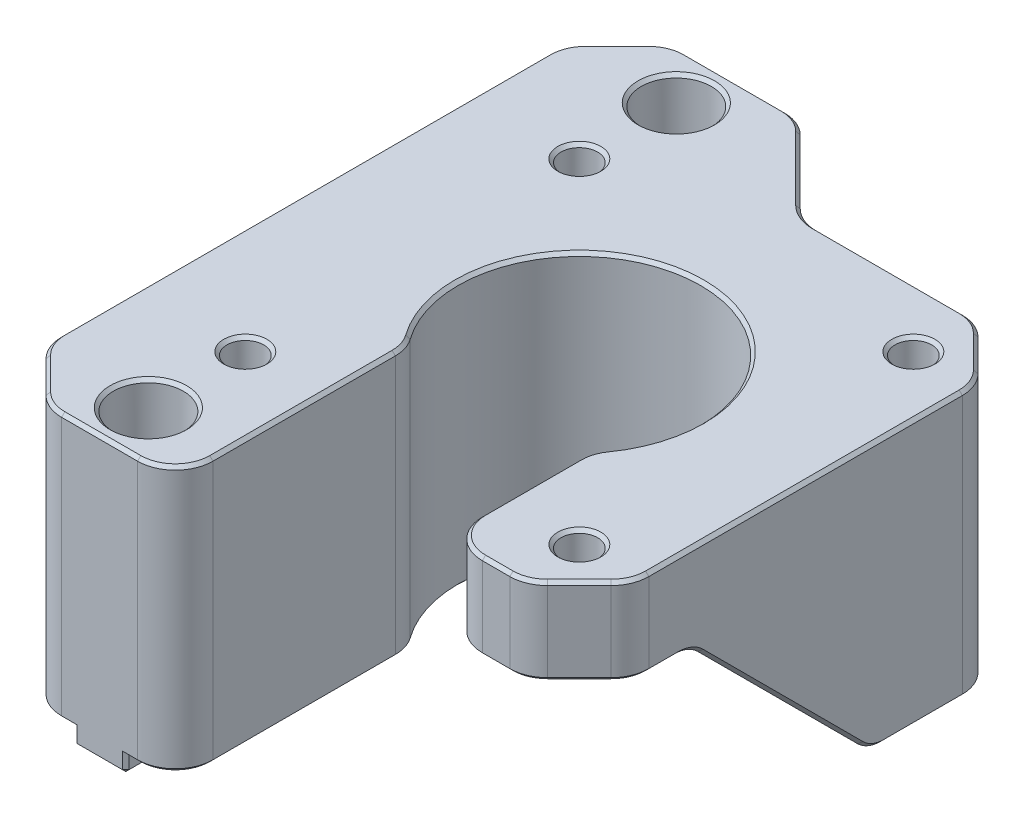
SolidWorks part; units mm, degrees
other "<Motorhalter>-<Fase3>"
ref_plane "Ebene vorne" through (0, 0, 0) normal (0, 0, 1) x (1, 0, 0)
ref_plane "Ebene oben" through (0, 0, 0) normal (0, 1, 0) x (1, 0, 0)
ref_plane "Ebene rechts" through (0, 0, 0) normal (1, 0, 0) x (0, 0, -1)
ref_plane "Aufriss-Motorhalter_Gespiegelt" through (51, 0, 0) normal (0, 0, 1) x (-1, 0, 0)
ref_plane "Grundriss-Motorhalter_Gespiegelt" through (51, 0, 0) normal (0, 1, 0) x (-1, 0, 0)
ref_plane "Seitenriss-Motorhalter_Gespiegelt" through (51, 0, 0) normal (-1, 0, 0) x (0, 0, -1)
mirrored part "Motorhalter_Gespiegelt" parameters "D1.Aufsatz-Linear austragen1"=24.6, "D1.Skizze1"=42, "D2.Skizze1"=42, "D1.Skizze2"=22.5, "D2.Skizze2"=8.5, "D3.Skizze2"=8.5, "Bohrerdurchmesser.Skizze4"=3.4, "Bohrungstiefe.Skizze4"=24.6, "Senkdurchmesser2.Skizze4"=6.5, "Senktiefe2.Skizze4"=3.4, "D1.Skizze3"=15.5, "D2.Skizze3"=15.5, "D3.Skizze3"=15.5, "D4.Skizze3"=15.5, "D1.Aufsatz-Linear austragen2"=4.5, "D1.Skizze5"=0, "D1.Aufsatz-Linear austragen3"=1.5, "D1.Skizze6"=10, "D2.Skizze6"=4.8, "D1.Aufsatz-Linear austragen4"=8, "D1.Skizze7"=0, "D1.Aufsatz-Linear austragen5"=8, "D1.Skizze8"=0, "Bohrerdurchmesser.Skizze10"=3.4, "Bohrungstiefe.Skizze10"=26.1, "Senkdurchmesser2.Skizze10"=6.5, "Senktiefe2.Skizze10"=4.9, "D1.Skizze9"=10, "D2.Skizze9"=4.5, "D3.Skizze9"=4.5, "D1.Fase1"=5, "D2.Fase1"=45, "D1.Verrundung1"=3.5, "D1.Skizze12"=27, "D2.Skizze12"=8, "Bohrerdurchmesser.Skizze14"=3.4, "Bohrungstiefe.Skizze14"=8, "Senkdurchmesser2.Skizze14"=6.5, "Senktiefe2.Skizze14"=3.4, "D1.Fase2"=16.6, "D2.Fase2"=45, "D1.Verrundung2"=3, "D1.Fase3"=0.3, "D2.Fase3"=45
